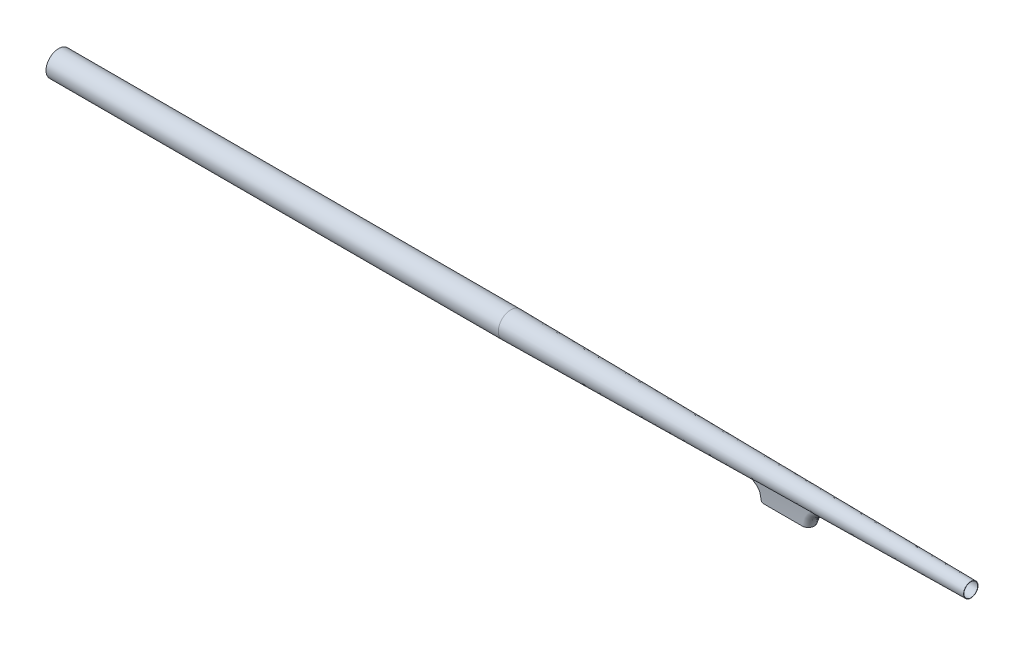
SolidWorks part; units mm, degrees
ref_plane "Ebene vorne" through (0, 0, 0) normal (0, 0, 1) x (1, 0, 0)
ref_plane "Ebene oben" through (0, 0, 0) normal (0, 1, 0) x (1, 0, 0)
ref_plane "Ebene rechts" through (0, 0, 0) normal (1, 0, 0) x (0, 0, -1)
sketch "Skizze1" plane through (0, 0, 0) normal (0, 0, 1) x (1, 0, 0)
  line L0 (0, 8.2) -> (0, 8)
  line L1 (295, 8.2) -> (595, 4.7)
  line L2 (0, 8) -> (295, 8)
  line L3 (295, 8) -> (595, 4.5)
  line L4 (0, 8.2) -> (295, 8.2)
  line L5 (595, 4.5) -> (595, 4.7)
  line L6 (0, 0) -> (595, 0) construction
  dimension "D1" = 16
  dimension "D2" = 0.2
  dimension "D3" = 295
  dimension "D4" = 595
  dimension "D5" = 9
  dimension "D6" = 0.2
revolve "Rotation1" add sketch "Skizze1" angle 360 about L6
ref_plane "Ebene1" through (0, 10, 0) normal (0, 1, 0) x (-1, 0, 0)
sketch "Skizze2" plane through (0, 10, 0) normal (0, 1, 0) x (-1, 0, 0)
  line L0 (0, 0) -> (-595, 0) construction
  line L1 (-595, 4.7) -> (-595, -4.7) construction
  line L2 (-495.0568, 4.8659) -> (-460.0615, 5.2742)
  line L3 (-295, 8.2) -> (-595, 4.7) construction
  line L4 (0, -8.2) -> (0, 8.2) construction
  line L5 (-495.0568, -4.8659) -> (-460.0615, -5.2742)
  arc A0 (-460.0615, -5.2742) -> (-460.0615, 5.2742) centre (-460, 0) ccw
  arc A1 (-495.0568, 4.8659) -> (-495.0568, -4.8659) centre (-495, 0) ccw
  dimension "D1" = 460
  dimension "D2" = 35
  dimension "D3" = 1
curve "Kurve3"
ref_plane "Ebene2" through (0, -15, 0) normal (0, 1, 0) x (-1, 0, 0)
sketch "Skizze3" plane through (0, -15, 0) normal (0, 1, 0) x (-1, 0, 0)
  line L0 (-489, 0) -> (-464, 0) construction
  line L1 (-489, -4) -> (-464, -4)
  line L2 (-489, 4) -> (-464, 4)
  line L3 (-595, 4.7) -> (-595, -4.7) construction
  arc A0 (-489, -4) -> (-489, 4) centre (-489, 0) cw
  arc A1 (-464, -4) -> (-464, 4) centre (-464, 0) ccw
  dimension "D3" = 25
  dimension "D4" = 106
  dimension "D1" = 4
  dimension "D2" = 4
sketch "Skizze4" plane through (0, 0, 0) normal (0, 0, 1) x (1, 0, 0)
  line L0 (295, -8.2) -> (595, -4.7) construction
  line L1 (464, -15) -> (460, -15) construction
  spline S0 degree 3 poles (454.7254, -6.3365) (456.518, -7.5217) (459.6985, -9.6244) (459.9084, -13.3668) (460, -15) knots 0 0 0 0 0.563599 1 1 1 1
sketch "Skizze5" plane through (0, 0, 0) normal (0, 0, 1) x (1, 0, 0)
  line L0 (493, -15) -> (489, -15) construction
  line L1 (295, -8.2) -> (595, -4.7) construction
  spline S0 degree 3 poles (493, -15) (493.4686, -13.3007) (494.5465, -9.392) (497.9452, -7.1035) (499.8663, -5.8099) knots 0 0 0 0 0.434759 1 1 1 1
sketch3d "3D-Skizze2"
  spline S4 degree 3 poles (920.0653, -1832.8097, 679.7219) (430.2711, -16.7217, 27.2195) (484.8292, 2.2576, -9.7574) (497.5089, -4.0563, -4.2142) (498.0044, -4.3892, -3.8748) (498.855, -4.9984, -3.0297) (499.2144, -5.2821, -2.5175) (499.7255, -5.6922, -1.3297) (499.8675, -5.8109, -0.6606) (499.865, -5.8088, 0.6793) (499.7195, -5.6872, 1.3499) (499.2054, -5.275, 2.5319) (498.8462, -4.9918, 3.0404) (497.9963, -4.3838, 3.8807) (497.504, -4.0532, 4.2172) (484.6246, 2.345, 9.8274) (432.316, -18.5591, -29.1433) (804.9852, -1859.2309, -670.2671) knots -2.582235 -2.582235 -2.582235 -2.582235 0.125 0.125 0.25 0.25 0.375 0.375 0.5 0.5 0.625 0.625 0.75 0.75 0.875 0.875 3.621566 3.621566 3.621566 3.621566 only from (495.0568, -3.2761, -4.8659) to (495.0568, -3.2761, 4.8659)
  spline S5 degree 3 poles (-1539.7191, -18.2165, -28.605) (-865.3695, -5.5187, -20.7376) (-190.9497, -5.6893, -12.8693) (1153.8806, -0.959, 2.8203) (1824.2914, 3.9131, 10.6418) (2494.5963, 27.8942, 18.462) knots -57.145864 -57.145864 -57.145864 -57.145864 0.66865 0.66865 58.141007 58.141007 58.141007 58.141007 only from (460.0615, -3.3984, -5.2742) to (495.0568, -3.2761, -4.8659)
  spline S6 degree 3 poles (96.0591, -1852.911, -660.4524) (524.7411, -13.2014, -26.0585) (470.5276, 2.6111, 10.1027) (457.3535, -4.321, 4.6113) (456.806, -4.7037, 4.2483) (455.8649, -5.4001, 3.3392) (455.4617, -5.7264, 2.7806) (454.8869, -6.1987, 1.4778) (454.7244, -6.3374, 0.7337) (454.7265, -6.3356, -0.7489) (454.8897, -6.1963, -1.4882) (455.4686, -5.7208, -2.7921) (455.869, -5.3968, -3.3446) (456.8145, -4.6977, -4.255) (457.3572, -4.3185, -4.6137) (470.759, 2.7198, -10.1817) (522.2831, -15.2787, 28.1249) (218.5032, -1876.3792, 650.4729) knots -2.418499 -2.418499 -2.418499 -2.418499 0.125 0.125 0.25 0.25 0.375 0.375 0.5 0.5 0.625 0.625 0.75 0.75 0.875 0.875 3.455811 3.455811 3.455811 3.455811 only from (460.0615, -3.3984, 5.2742) to (460.0615, -3.3984, -5.2742)
  spline S7 degree 3 poles (2494.6184, 27.4248, -18.4623) (1820.6324, 3.786, -10.5991) (1146.5526, -1.0117, -2.7348) (-198.2869, -5.6878, 12.9549) (-869.0467, -5.5891, 20.7805) (-1539.7315, -17.7926, 28.6051) knots -57.14127 -57.14127 -57.14127 -57.14127 0.645588 0.645588 58.146371 58.146371 58.146371 58.146371 only from (495.0568, -3.2761, 4.8659) to (460.0615, -3.3984, 5.2742)
  spline S8 degree 3 poles (495.0568, -3.2761, -4.8659) (495.7396, -3.2736, -4.858) (496.3897, -3.499, -4.7034) (497.5089, -4.0563, -4.2142) (498.0044, -4.3892, -3.8748) (498.855, -4.9984, -3.0297) (499.2144, -5.2821, -2.5175) (499.7255, -5.6922, -1.3297) (499.8675, -5.8109, -0.6606) (499.865, -5.8088, 0.6793) (499.7195, -5.6872, 1.3499) (499.2054, -5.275, 2.5319) (498.8462, -4.9918, 3.0404) (497.9963, -4.3838, 3.8807) (497.504, -4.0532, 4.2172) (496.3827, -3.4962, 4.7056) (495.7392, -3.2736, 4.858) (495.0568, -3.2761, 4.8659) knots 0 0 0 0 0.125 0.125 0.25 0.25 0.375 0.375 0.5 0.5 0.625 0.625 0.75 0.75 0.875 0.875 1 1 1 1
  spline S9 degree 3 poles (460.0615, -3.3984, -5.2742) (467.8614, -3.3716, -5.1832) (475.6613, -3.3446, -5.0922) (487.3263, -3.3035, -4.9561) (491.1916, -3.2898, -4.911) (495.0568, -3.2761, -4.8659) knots 0 0 0 0 0.66865 0.66865 1 1 1 1
  spline S10 degree 3 poles (460.0615, -3.3984, 5.2742) (459.3055, -3.401, 5.283) (458.5877, -3.6716, 5.1258) (457.3535, -4.321, 4.6113) (456.806, -4.7037, 4.2483) (455.8649, -5.4001, 3.3392) (455.4617, -5.7264, 2.7806) (454.8869, -6.1987, 1.4778) (454.7244, -6.3374, 0.7337) (454.7265, -6.3356, -0.7489) (454.8897, -6.1963, -1.4882) (455.4686, -5.7208, -2.7921) (455.869, -5.3968, -3.3446) (456.8145, -4.6977, -4.255) (457.3572, -4.3185, -4.6137) (458.5954, -3.6682, -5.1281) (459.3054, -3.401, -5.283) (460.0615, -3.3984, -5.2742) knots 0 0 0 0 0.125 0.125 0.25 0.25 0.375 0.375 0.5 0.5 0.625 0.625 0.75 0.75 0.875 0.875 1 1 1 1
  spline S11 degree 3 poles (495.0568, -3.2761, 4.8659) (487.5259, -3.3029, 4.9538) (479.9951, -3.3294, 5.0417) (468.33, -3.3699, 5.1777) (464.1958, -3.3842, 5.226) (460.0615, -3.3984, 5.2742) knots 0 0 0 0 0.645588 0.645588 1 1 1 1
  point P4 (536.5367, -9.3733, 0)
  dimension "D1" = 0
surface "Oberfläche-Ausformung1"
surface "Oberflächenausfüllung1"
